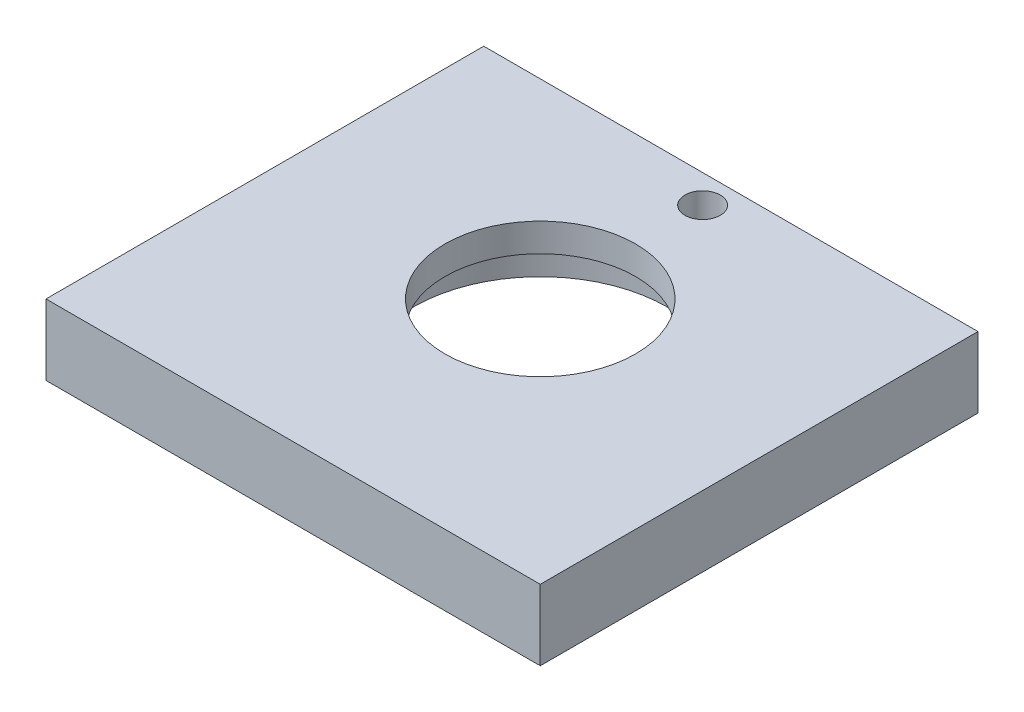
SolidWorks part; units mm, degrees
ref_plane "Plan de face" through (0, 0, 0) normal (0, 0, 1) x (1, 0, 0)
ref_plane "Plan de dessus" through (0, 0, 0) normal (0, 1, 0) x (1, 0, 0)
ref_plane "Plan de droite" through (0, 0, 0) normal (1, 0, 0) x (0, 0, -1)
sketch "Esquisse1" plane through (0, 0, 0) normal (0, 0, 1) x (1, 0, 0)
  line L1 (-80, 135) -> (-10, 135)
  line L2 (-80, 135) -> (-80, 125)
  line L3 (-80, 125) -> (-10, 125)
  line L4 (-10, 135) -> (-10, 125)
extrude "Boss.-Extru.1" add sketch "Esquisse1" along normal blind 62
sketch "Esquisse2" plane through (0, 135, 0) normal (0, 1, 0) x (1, 0, 0)
  line L0 (-45, -62) -> (-45, 0) construction
  line L1 (-10, -62) -> (-80, -62) construction
  line L2 (-10, 0) -> (-80, 0) construction
  line L3 (-21.4283, 8) -> (-68.5717, 8) construction
  circle A0 centre (-45, -27) radius 13.5
  circle A1 centre (-45, -4) radius 2.5
  dimension "D1" = 27
  dimension "D4" = 5
  dimension "D2" = 35
  dimension "D3" = 12
extrude "Enlèv. mat.-Extru.1" cut sketch "Esquisse2" against normal blind 62
hole_wizard "Trou taraudé M5x0.81" positions "Esquisse4" profile "Esquisse3" tap size "M5x0.8" standard "Ansi Metric"
sketch "Esquisse4" plane through (0, 0, 0) normal (0, 0, -1) x (-1, 0, 0)
  line L0 (10, 125) -> (10, 135) construction
  line L1 (10, 135) -> (80, 135) construction
  line L2 (80, 135) -> (80, 125) construction
  point P0 (20, 130)
  point P2 (70, 130)
  dimension "D1" = 10
  dimension "D2" = 5
  dimension "D3" = 10
  dimension "D4" = 5
sketch "Esquisse3" plane through (-20, 130, 0) normal (1, 0, 0) x (0, 1, 0)
  line L0 (0, 0) -> (0, 16.2618)
  line L1 (0, 16.2618) -> (2.1, 15)
  line L2 (2.1, 15) -> (2.1, 0)
  line L5 (2.1, 0) -> (0, 0)
  line L10 (0, 16.2618) -> (-2.1, 15) construction
  line L11 (0, -6.35) -> (0, 107.95) construction
  dimension "Diamètre du trou pour taraudage" = 4.2
  dimension "Profondeur du trou pour taraudage" = 15
  dimension "Angle de pointe" = 118
sketch "Esquisse5" plane through (0, 125, 0) normal (0, -1, 0) x (1, 0, 0)
  circle A2 centre (-45, 27) radius 18
  dimension "D1" = 36
extrude "Enlèv. mat.-Extru.2" cut sketch "Esquisse5" against normal blind 6
